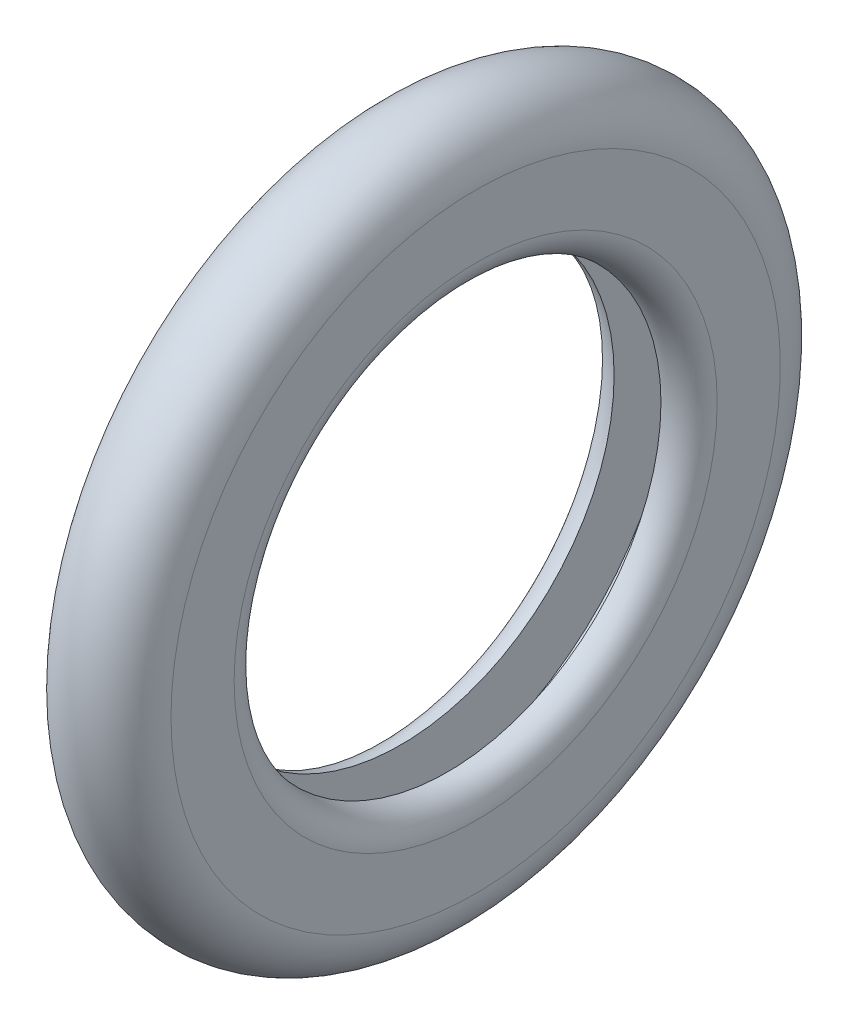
SolidWorks part; units mm, degrees
ref_plane "Front" through (0, 0, 0) normal (0, 0, 1) x (1, 0, 0)
ref_plane "Top" through (0, 0, 0) normal (0, 1, 0) x (1, 0, 0)
ref_plane "Right" through (0, 0, 0) normal (1, 0, 0) x (0, 0, -1)
sketch "Sketch1" plane through (0, 0, 0) normal (0, 0, 1) x (1, 0, 0)
  line L0 (10.16, 28.9306) -> (13.97, 28.9306)
  line L1 (0, 0) -> (13.97, 0) construction
  line L2 (0, 41.3004) -> (0, 28.9306)
  line L3 (0, 28.9306) -> (3.81, 28.9306)
  line L4 (13.97, 41.3004) -> (13.97, 28.9306)
  line L6 (3.81, 28.9306) -> (3.81, 37.465)
  line L7 (3.81, 37.465) -> (10.16, 37.465)
  line L8 (10.16, 28.9306) -> (10.16, 37.465)
  arc A0 (13.97, 41.3004) -> (0, 41.3004) centre (6.985, 41.3004) ccw
  dimension "D4" = 8.5344
  dimension "D1" = 13.97
  dimension "D2" = 12.3698
  dimension "D3" = 6.35
  dimension "D5" = 37.465
revolve "Revolve1" add sketch "Sketch1" angle 360 about L1
fillet "Fillet1" radius 3.81 2 edges at (13.97, 0, 28.9306) (0, 0, 28.9306)
